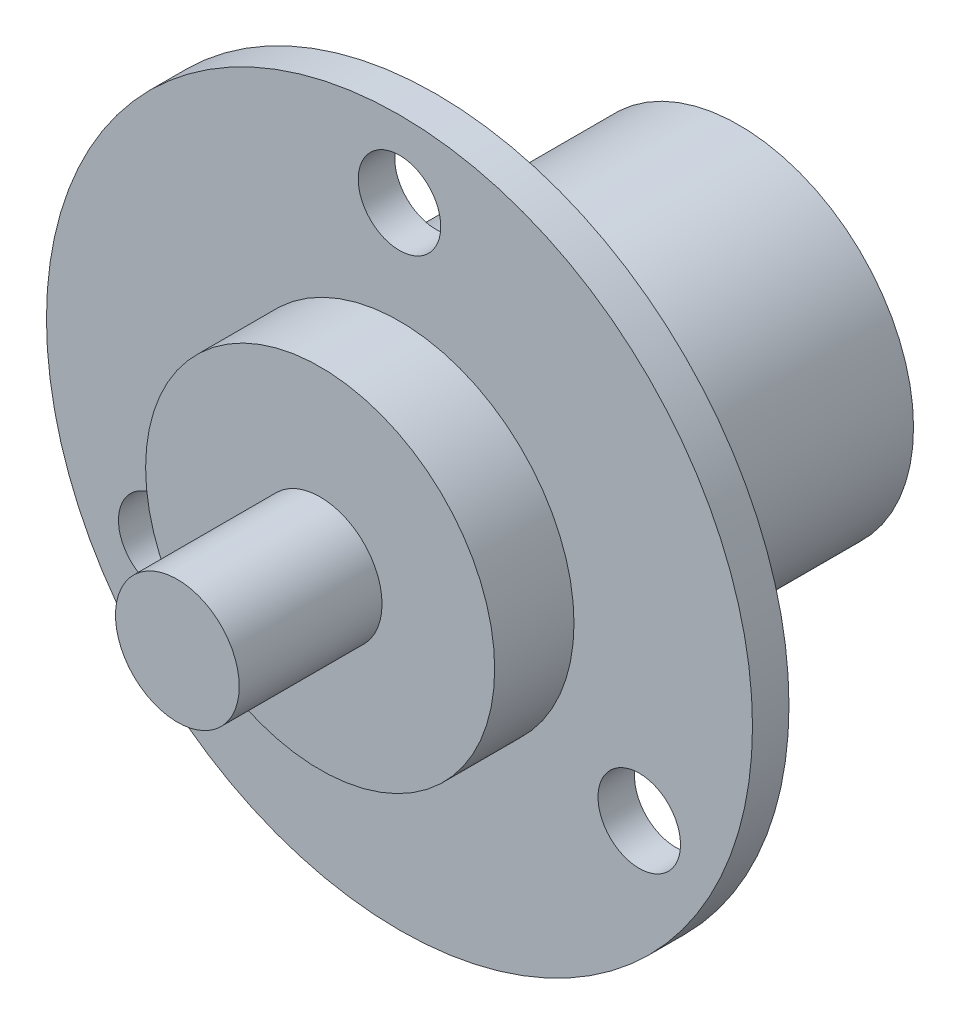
SolidWorks part; units mm, degrees
ref_plane "前视基准面" through (0, 0, 0) normal (0, 0, 1) x (1, 0, 0)
ref_plane "上视基准面" through (0, 0, 0) normal (0, 1, 0) x (1, 0, 0)
ref_plane "右视基准面" through (0, 0, 0) normal (1, 0, 0) x (0, 0, -1)
other "Configuration Table"
sketch "草图1" plane through (0, 0, 0) normal (0, 0, 1) x (1, 0, 0)
  circle A0 centre (0, 0) radius 11
  dimension "D1" = 22
extrude "凸台-拉伸1" add sketch "草图1" along normal blind 26.4
ref_plane "基准面1" through (0, 0, 21.4) normal (0, 0, 1) x (1, 0, 0)
sketch "草图2" plane through (0, 0, 21.4) normal (0, 0, 1) x (1, 0, 0)
  line L0 (0, 25.9309) -> (0, -0.2216) construction
  line L1 (0, 0) -> (-23.1795, -13.3827) construction
  line L2 (0, 0) -> (22.2514, -12.8469) construction
  circle A0 centre (0, 0) radius 22.25
  circle A1 centre (0, 0) radius 17.45 construction
  circle A2 centre (0, 17.45) radius 2.6
  circle A3 centre (15.1121, -8.725) radius 2.6
  circle A4 centre (-15.1121, -8.725) radius 2.6
  point P12 (0, 0)
  dimension "D1" = 44.5
  dimension "D2" = 34.9
  dimension "D5" = 5.2
  dimension "D6" = 5.2
  dimension "D7" = 5.2
  dimension "D3" = 120
  dimension "D4" = 120
extrude "凸台-拉伸2" add sketch "草图2" against normal blind 2.3
sketch "草图3" plane through (0, 0, 26.4) normal (0, 0, 1) x (1, 0, 0)
  circle A0 centre (0, 0) radius 3.9
  dimension "D1" = 7.8
extrude "凸台-拉伸3" add sketch "草图3" along normal blind 9
